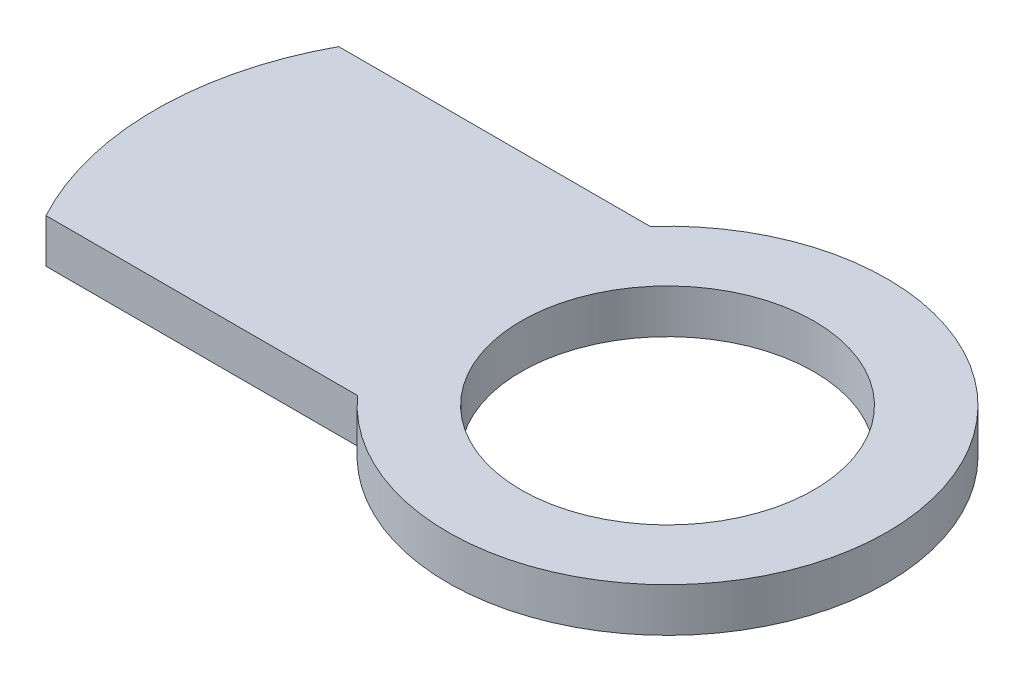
SolidWorks part; units mm, degrees
ref_plane "Front Plane" through (0, 0, 0) normal (0, 0, 1) x (1, 0, 0)
ref_plane "Top Plane" through (0, 0, 0) normal (0, 1, 0) x (1, 0, 0)
ref_plane "Right Plane" through (0, 0, 0) normal (1, 0, 0) x (0, 0, -1)
sketch "Sketch1" plane through (0, 0, 0) normal (0, 1, 0) x (1, 0, 0)
  line L0 (0, 0) -> (-35, 0) construction
  line L1 (-11.1803, 10) -> (-32.4662, 10)
  line L2 (-11.1803, -10) -> (-32.4662, -10)
  line L3 (0, 10) -> (-35, 10) construction
  line L4 (0, -10) -> (-35, -10) construction
  circle A0 centre (0, 0) radius 10
  arc A1 (-11.1803, -10) -> (-11.1803, 10) centre (0, 0) ccw
  arc A2 (-32.4662, 10) -> (-32.4662, -10) centre (-14, 0) ccw
  dimension "D3" = 20
  dimension "D4" = 15
  dimension "D5" = 21
  dimension "D1" = 10
  dimension "D2" = 10
  dimension "D6" = 35
extrude "Extrude1" add sketch "Sketch1" along normal blind 3
